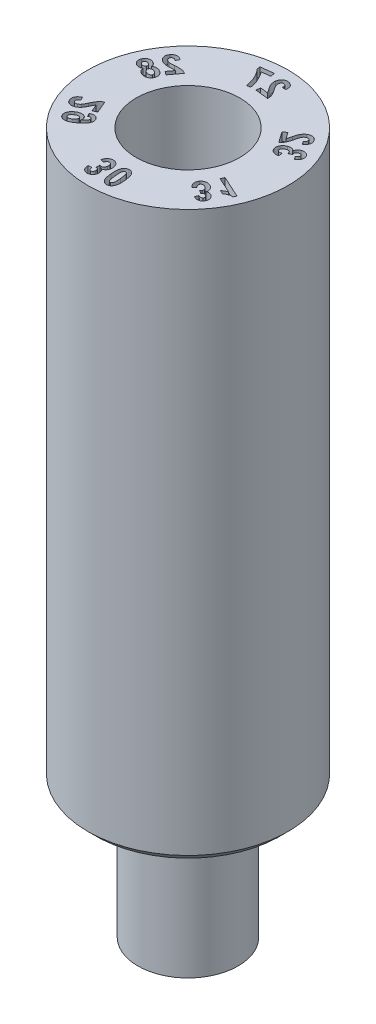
SolidWorks part; units mm, degrees
other "<M3L8-SetScrew>-<Chamfer1>" parameters "D10"=0.24
ref_plane "Front Plane" through (0, 0, 0) normal (0, 0, 1) x (1, 0, 0)
ref_plane "Top Plane" through (0, 0, 0) normal (0, 1, 0) x (1, 0, 0)
ref_plane "Right Plane" through (0, 0, 0) normal (1, 0, 0) x (0, 0, -1)
sketch "Sketch1" plane through (0, 0, 0) normal (0, 0, 1) x (1, 0, 0)
  line L0 (0, 0) -> (0, 20) construction
  line L1 (0, -3.3) -> (0, 3.3) construction
  line L2 (1.5, -17) -> (2.76, -17)
  line L4 (3, -16.76) -> (3, 0)
  line L5 (3, 0) -> (1.55, 0)
  line L6 (1.55, 0) -> (1.55, -2.8)
  line L7 (1.55, -2.8) -> (0.8, -2.8)
  line L8 (0.8, -2.8) -> (0.8, -13)
  line L9 (0.8, -13) -> (1.5, -13)
  line L10 (1.5, -13) -> (1.5, -17)
  line L11 (2.76, -17) -> (3, -16.76)
  point P6 (3, -17)
  dimension "D1" = 2.8
  dimension "D2" = 4
  dimension "D3" = 1.6
  dimension "D4" = 3.1
  dimension "D5" = 6
  dimension "D6" = 3
  dimension "D7" = 17
revolve "Revolve1" add sketch "Sketch1" angle 360 about L0
sketch "Sketch2" plane through (0, 0, 0) normal (0, 1, 0) x (1, 0, 0)
  line L0 (0, 0) -> (0, 2.1482) construction
  line L1 (0, 0) -> (1.8604, 1.0741) construction
  line L2 (0, 0) -> (1.8604, -1.0741) construction
  line L3 (0, 0) -> (0, -2.1482) construction
  line L4 (0, 0) -> (-1.8604, -1.0741) construction
  line L5 (0, 0) -> (-1.8604, 1.0741) construction
  arc A0 (0.4557, 1.9474) -> (1.2335, 1.5743) centre (0, 0) ccw construction
  text T0 "27     28     29     30     31     32" font "Arial Narrow" height 0.72
  point P12 (0, 0)
  point P16 (0, 0)
  point P17 (0, 0)
  point P20 (0, 0)
  dimension "D1" = 4
  dimension "D2" = 6
extrude "Cut-Extrude1" cut sketch "Sketch2" against normal blind 0.25
inserted part "M3L8-SetScrew"
move or copy body "Body-Move/Copy4" placed by mates yes
other "Distance1" parameters "D1"=4
